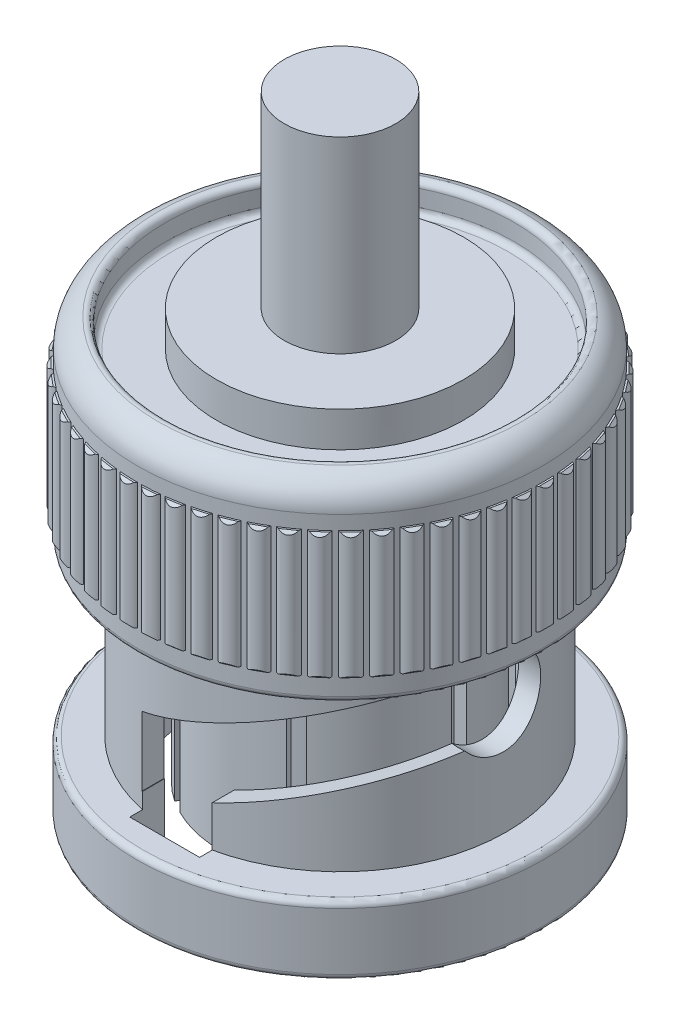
SolidWorks part; units mm, degrees
ref_plane "Front Plane" through (0, 0, 0) normal (0, 0, 1) x (1, 0, 0)
ref_plane "Top Plane" through (0, 0, 0) normal (0, 1, 0) x (1, 0, 0)
ref_plane "Right Plane" through (0, 0, 0) normal (1, 0, 0) x (0, 0, -1)
imported_body "Imported3"
sketch "Sketch1" plane through (-4.4054, 0, 0) normal (1, 0, 0) x (0, 0, -1)
  circle A0 centre (-6.6414, -4.6176) radius 1.465
extrude "Boss-Extrude1" add sketch "Sketch1" along normal blind 0.7661
hole_wizard "Hole1" positions "Sketch3" profile "Sketch2" legacy
sketch "Sketch3" plane through (0, -9.3484, 0) normal (0, -1, 0) x (-1, 0, 0)
  point P0 (-1.1193, -6.7796)
sketch "Sketch2" plane through (1.1193, -9.3484, 6.7796) normal (1, 0, 0) x (0, 0, -1)
  line L0 (0, 0) -> (0, 5)
  line L1 (0, 5) -> (2.43, 5)
  line L2 (2.43, 5) -> (2.43, 0)
  line L3 (2.43, 0) -> (0, 0)
  line L4 (0, 110) -> (0, -10) construction
  dimension "Diameter" = 4.86
  dimension "Depth" = 5
draft "Draft1" type of draft neutral plane draft angle 19.802 faces to draft 1 parameters "D1"=19.802
draft "Draft2" type of draft neutral plane draft angle 19.802 faces to draft 1 parameters "D1"=19.802
ref_plane "Plane1" through (0, 0, 6.7796) normal (0, 0, 1) x (1, 0, 0)
sketch "Sketch4" plane through (0, 0, 6.7796) normal (0, 0, 1) x (1, 0, 0)
  line L0 (4.1193, 20.4616) -> (1.1193, 20.4616)
  line L1 (1.1193, 20.4616) -> (1.1193, 2.9216)
  line L2 (1.1193, 2.9216) -> (5.8183, 2.9216)
  line L3 (5.8183, 2.9216) -> (5.8183, 5.4616)
  line L4 (5.8183, 5.4616) -> (4.1193, 5.4616)
  line L5 (4.1193, 5.4616) -> (4.1193, 13.4616)
  line L6 (4.1193, 13.4616) -> (4.3872, 13.4616)
  line L7 (4.3872, 13.4616) -> (4.1193, 14.4616)
  line L8 (4.1193, 14.4616) -> (4.1193, 16.4616)
  line L9 (4.1193, 16.4616) -> (4.3872, 16.4616)
  line L10 (4.3872, 16.4616) -> (4.1193, 17.4616)
  line L11 (4.1193, 17.4616) -> (4.1193, 19.4616)
  line L12 (4.1193, 19.4616) -> (4.3872, 19.4616)
  line L13 (4.3872, 19.4616) -> (4.1193, 20.4616)
  line L14 (1.1193, 20.4616) -> (1.1193, 2.9216) construction
revolve "Revolve1" add sketch "Sketch4" angle 360 about L14
ref_plane "Plane2" through (0, 0, 6.6414) normal (0, 0, 1) x (1, 0, 0)
sketch "Sketch5" plane through (0, 0, 6.6414) normal (0, 0, 1) x (1, 0, 0)
  line L0 (-4.5507, -3.1526) -> (-4.5507, -4.6176)
  line L1 (-4.5507, -4.6176) -> (-3.6392, -4.6176)
  line L2 (-3.6392, -4.6176) -> (-3.6392, -3.1526)
  line L3 (-3.6392, -3.1526) -> (-4.5507, -3.1526)
  line L4 (-4.5507, -4.6176) -> (-3.6392, -4.6176) construction
revolve "Cut-Revolve1" cut sketch "Sketch5" angle 360 about L4
ref_plane "Plane3" through (0, 0, 6.9178) normal (0, 0, -1) x (-1, 0, 0)
sketch "Sketch6" plane through (0, 0, 6.9178) normal (0, 0, -1) x (-1, 0, 0)
  line L0 (-6.7893, -3.1526) -> (-6.7893, -4.6176)
  line L1 (-6.7893, -4.6176) -> (-5.8777, -4.6176)
  line L2 (-5.8777, -4.6176) -> (-5.8777, -3.1526)
  line L3 (-5.8777, -3.1526) -> (-6.7893, -3.1526)
  line L4 (-6.7893, -4.6176) -> (-5.8777, -4.6176) construction
revolve "Cut-Revolve2" cut sketch "Sketch6" angle 360 about L4
ref_plane "Plane4" through (0, 0, 6.7796) normal (0, 0, -1) x (-1, 0, 0)
sketch "Sketch7" plane through (0, 0, 6.7796) normal (0, 0, -1) x (-1, 0, 0)
  line L0 (-1.2337, -9.3484) -> (-1.1193, -9.3484)
  line L1 (-1.1193, -9.3484) -> (-1.1193, -4.3484)
  line L2 (-1.1193, -4.3484) -> (-2.1193, -4.3484)
  line L3 (-2.1193, -4.3484) -> (-2.1193, -4.8484)
  line L4 (-2.1193, -4.8484) -> (-1.6193, -4.8484)
  line L5 (-1.6193, -4.8484) -> (-1.6193, -8.7258)
  line L6 (-1.6193, -8.7258) -> (-1.3743, -9.2117)
  line L7 (-1.1193, -9.3484) -> (-1.1193, -4.3484) construction
  arc A0 (-1.3743, -9.2117) -> (-1.2337, -9.3484) centre (-1.1064, -9.0767) ccw
revolve "Revolve2" add sketch "Sketch7" angle 360 about L7
hole_wizard "Ø5.0 (5) Diameter Hole1" positions "Sketch9" profile "Sketch8" hole size "Ø5.0" standard "ANSI Metric"
sketch "Sketch9" plane through (0, 20.4616, 0) normal (0, 1, 0) x (1, 0, 0)
  point P0 (1.1193, -6.7796)
sketch "Sketch8" plane through (1.1193, 20.4616, 6.7796) normal (1, 0, 0) x (0, 0, 1)
  line L0 (0, 0) -> (0, 15)
  line L1 (0, 15) -> (2.5, 15)
  line L2 (2.5, 15) -> (2.5, 0)
  line L5 (2.5, 0) -> (0, 0)
  line L10 (0, 15) -> (-2.5, 15) construction
  line L11 (0, -6.35) -> (0, 107.95) construction
  dimension "Hole Dia." = 5
  dimension "Hole Depth" = 15
  dimension "Drill Angle" = 180
fillet "Fillet1" radius 0.05 7 edges at (4.3872, 13.4616, 6.7796) (4.3872, 19.4616, 6.7796) (4.3872, 16.4616, 6.7796) (4.1193, 19.4616, 6.7796) (4.1193, 13.4616, 6.7796) (4.1193, 16.4616, 6.7796) (5.8183, 5.4616, 6.7796)
chamfer "Chamfer1" distance 0.5 angle 45 2 edges at (-3.8207, -10.8484, 6.7796) (6.0593, -10.8484, 6.7796)
fillet "Fillet2" radius 0.2 6 edges at (1.1193, -10.8484, 13.6996) (1.1193, -2.6584, 12.4496) (1.1193, -8.4984, 13.6996) (1.1193, -2.6584, 13.6846) (1.1193, 2.9216, 0.8396) (5.8183, 2.9216, 6.7796)
fillet "Fillet3" radius 0.5 1 edges at (4.1193, 5.4616, 6.7796)
ref_plane "Plane5" through (0, 32.0616, 0) normal (0, 1, 0) x (1, 0, 0)
sketch "Sketch17" plane through (0, 32.0616, 0) normal (0, 1, 0) x (1, 0, 0)
  circle A0 centre (1.1193, -6.7796) radius 5.447
extrude "Cut-Extrude1" cut sketch "Sketch17" against normal up to surface (29.14 mm away)
sketch "Sketch18" plane through (0, 2.9216, 0) normal (0, 1, 0) x (-1, 0, 0)
  circle A0 centre (-1.1193, 6.7796) radius 4.21
extrude "Boss-Extrude2" add sketch "Sketch18" along normal blind 1.2
sketch "Sketch19" plane through (0, 4.1216, 0) normal (0, 1, 0) x (-1, 0, 0)
  circle A0 centre (-1.1193, 6.7796) radius 1.9
extrude "Boss-Extrude3" add sketch "Sketch19" along normal blind 6.4
